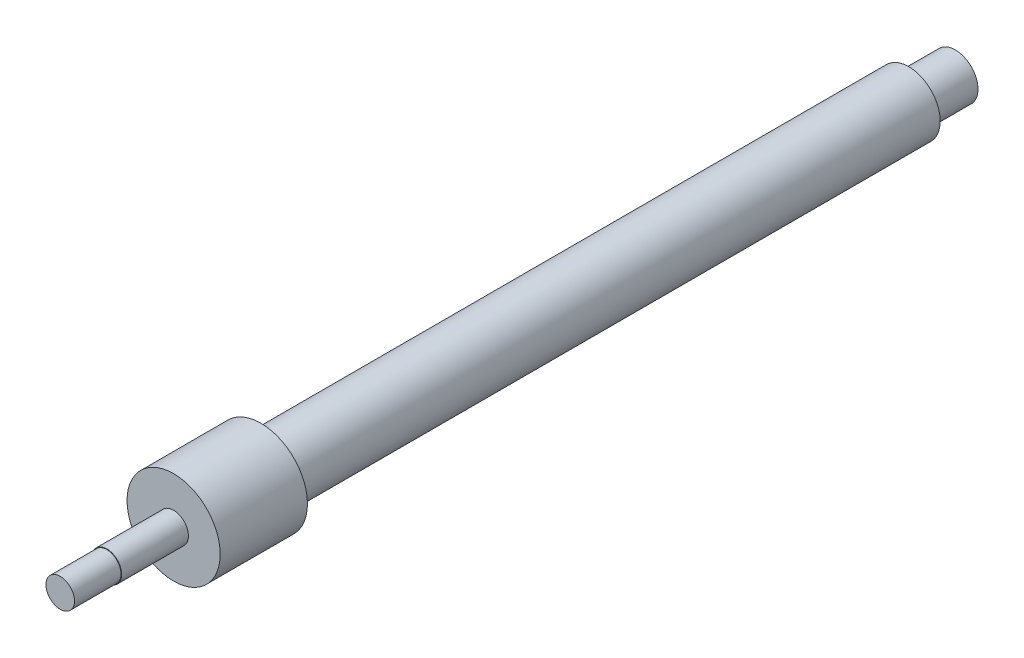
SolidWorks part; units mm, degrees
ref_plane "Plano frontal" through (0, 0, 0) normal (0, 0, 1) x (1, 0, 0)
ref_plane "Plano superior" through (0, 0, 0) normal (0, 1, 0) x (1, 0, 0)
ref_plane "Plano direito" through (0, 0, 0) normal (1, 0, 0) x (0, 0, -1)
sketch "Esboço1" plane through (0, 0, 0) normal (0, 0, 1) x (1, 0, 0)
  circle A0 centre (0, 0) radius 2.7
  dimension "D1" = 5.4
extrude "Ressalto-extrusão1" add sketch "Esboço1" along normal blind 55.66
sketch "Esboço2" plane through (0, 0, 55.66) normal (0, 0, 1) x (1, 0, 0)
  circle A0 centre (0, 0) radius 1.225
  dimension "D1" = 2.45
extrude "Ressalto-extrusão2" add sketch "Esboço2" along normal blind 17.24
sketch "Esboço3" plane through (0, 0, 0) normal (0, 0, -1) x (-1, 0, 0)
  circle A0 centre (0, 0) radius 1.95
  dimension "D1" = 3.9
extrude "Ressalto-extrusão3" add sketch "Esboço3" along normal blind 4
sketch "Esboço4" plane through (0, 0, 55.66) normal (0, 0, 1) x (1, 0, 0)
  line L0 (0, 1.225) -> (0, 2.7) construction
  line L1 (-2.4061, 1.225) -> (2.4061, 1.225) construction
  line L2 (-2.4061, 1.225) -> (2.4061, 1.225)
  line L3 (2.4061, 1.225) -> (2.4061, 2.7)
  line L4 (2.4061, 2.7) -> (-2.4061, 2.7)
  line L5 (-2.4061, 2.7) -> (-2.4061, 1.225)
  circle A0 centre (0, 0) radius 1.225 construction
  circle A1 centre (0, 0) radius 1.225 construction
  circle A3 centre (0, 0) radius 2.7 construction
  circle A4 centre (0, 0) radius 2.7 construction
ref_plane "Plano1" through (0, 0, 55.66) normal (0, 0, 1) x (1, 0, 0)
sketch "Esboço5" plane through (0, 0, 55.66) normal (0, 0, 1) x (1, 0, 0)
  line L0 (-2.4061, 2.7) -> (-2.4061, 1.225) construction
  line L1 (2.4061, 2.7) -> (-2.4061, 2.7) construction
  line L2 (2.4061, 1.225) -> (2.4061, 2.7) construction
  line L3 (-2.4061, 1.225) -> (2.4061, 1.225) construction
  line L4 (-2.4061, 2.7) -> (-2.4061, 1.225)
  line L5 (2.4061, 2.7) -> (-2.4061, 2.7)
  line L6 (2.4061, 1.225) -> (2.4061, 2.7)
  line L7 (-2.4061, 1.225) -> (2.4061, 1.225)
ref_plane "Plano2" through (0, 0, 68.9) normal (0, 0, 1) x (1, 0, 0)
sketch "Esboço6" plane through (0, 0, 68.9) normal (0, 0, 1) x (1, 0, 0)
  circle A0 centre (0, 0) radius 1.275
  dimension "D1" = 2.55
extrude "Ressalto-extrusão4" add sketch "Esboço6" against normal blind 7
sketch "Esboço8" plane through (0, 0, 61.9) normal (0, 0, -1) x (-1, 0, 0)
  circle A0 centre (0, 0) radius 4
  dimension "D1" = 8
extrude "Ressalto-extrusão6" add sketch "Esboço8" against normal blind 1.26 and the other way up to surface (6.24 mm away)
